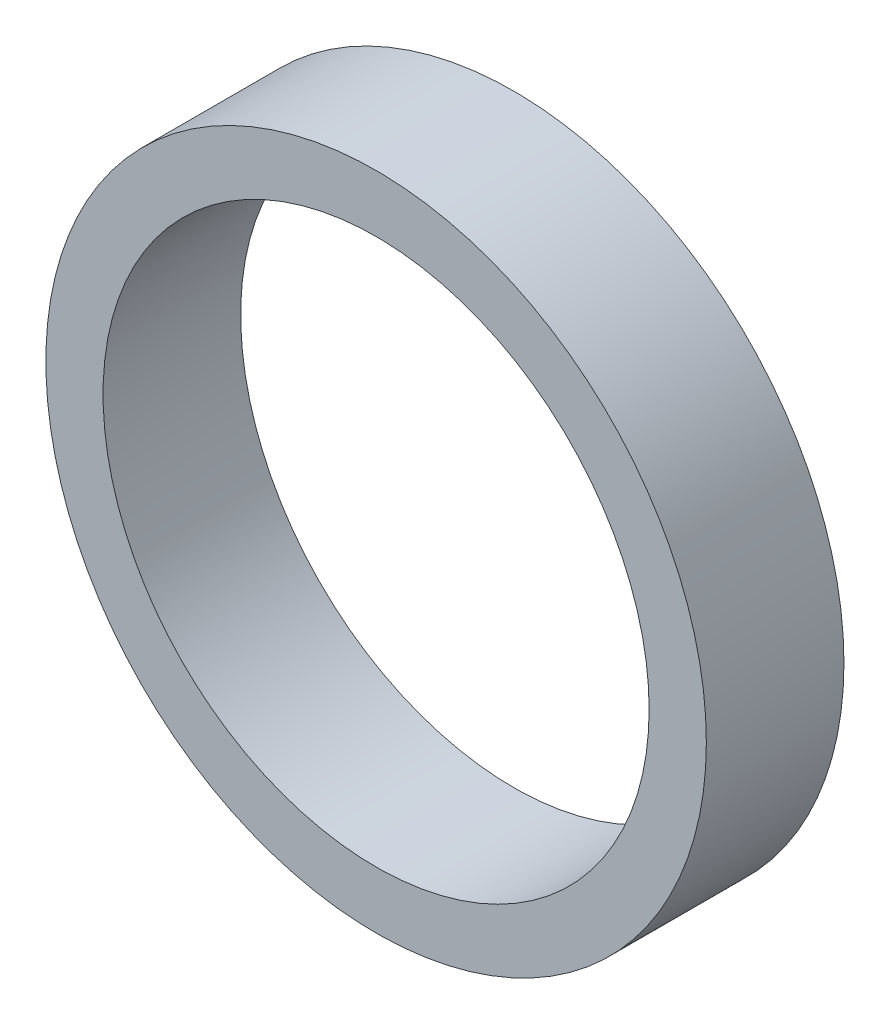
SolidWorks part; units mm, degrees
ref_plane "Front Plane" through (0, 0, 0) normal (0, 0, 1) x (1, 0, 0)
ref_plane "Top Plane" through (0, 0, 0) normal (0, 1, 0) x (1, 0, 0)
ref_plane "Right Plane" through (0, 0, 0) normal (1, 0, 0) x (0, 0, -1)
sketch "Sketch1" plane through (0, 0, 0) normal (0, 0, 1) x (1, 0, 0)
  circle A0 centre (0, 0) radius 7.62
  circle A1 centre (0, 0) radius 6.3
  dimension "D1" = 15.24
  dimension "D2" = 12.6
extrude "Boss-Extrude1" add sketch "Sketch1" along normal blind 3.175
